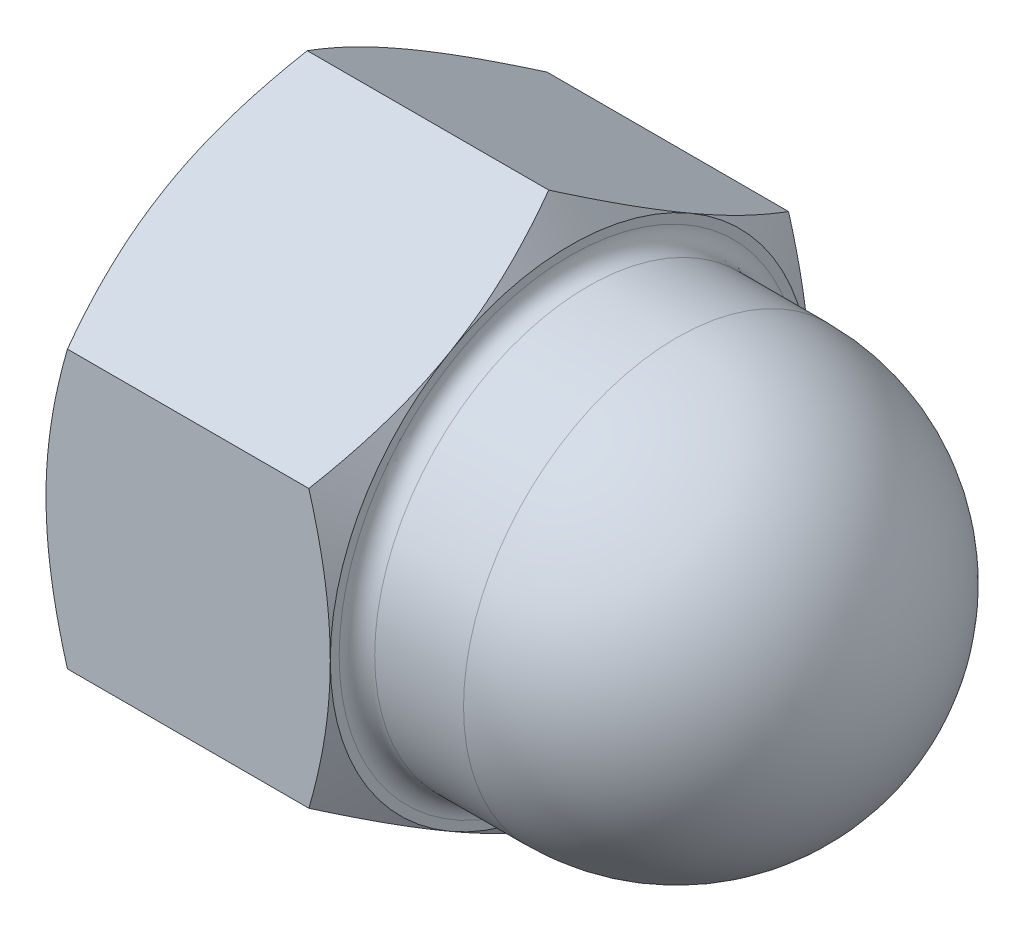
SolidWorks part; units mm, degrees
ref_plane "Plane1" through (0, 0, 0) normal (0, 0, 1) x (1, 0, 0)
ref_plane "Plane2" through (0, 0, 0) normal (0, 1, 0) x (1, 0, 0)
ref_plane "Plane3" through (0, 0, 0) normal (1, 0, 0) x (0, 0, -1)
sketch "BaseNutSke" plane through (0, 0, 0) normal (1, 0, 0) x (0, 0, -1)
  line L6 (13.5, 7.7942) -> (13.5, -7.7942)
  line L7 (-13.5, 7.7942) -> (-13.5, -7.7942)
  line L8 (13.5, 7.7942) -> (0, 15.5885)
  line L9 (0, 15.5885) -> (-13.5, 7.7942)
  line L10 (-13.5, -7.7942) -> (0, -15.5885)
  line L11 (0, -15.5885) -> (13.5, -7.7942)
  dimension "D4" = 60
  dimension "D1" = 120
  dimension "D2" = 13.5
  dimension "D3" = 13.5
  dimension "Width_flats" = 27
extrude "BaseNut" add sketch "BaseNutSke" along normal blind 16
sketch "DomeSke" plane through (0, 0, 0) normal (0, 0, 1) x (1, 0, 0)
  line L0 (0, 0) -> (63.5, 0) construction
  line L1 (0, 7.7942) -> (0, -7.7942) construction
  line L2 (34, 0) -> (0, 0)
  line L3 (0, 12) -> (22, 12)
  line L4 (0, -12) -> (22.225, -12) construction
  line L5 (0, 12) -> (0, 0)
  arc A0 (22, 12) -> (34, 0) centre (22, 0) cw
  dimension "Dome_rad" = 12
  dimension "Overall_ht" = 34
revolve "Dome" add sketch "DomeSke" angle 360 about L0
sketch "Sketch4" plane through (0, 0, 0) normal (0, 0, 1) x (1, 0, 0)
  line L0 (0, 13.5) -> (2.5048, 17.8385)
  line L1 (16, 13.5) -> (13.4952, 17.8385)
  line L2 (2.5048, 17.8385) -> (13.4952, 17.8385)
  line L3 (16, 13.5) -> (18, 13.5)
  line L4 (18, 13.5) -> (18, 28.5)
  line L5 (18, 28.5) -> (-2, 28.5)
  line L6 (0, 13.5) -> (-2, 13.5)
  line L7 (-2, 13.5) -> (-2, 28.5)
  line L8 (16, 15.5885) -> (16, 7.7942) construction
  line L9 (0, 15.5885) -> (0, 7.7942) construction
  line L10 (0, 0) -> (57.15, 0) construction
  line L11 (16, 15.5885) -> (0, 15.5885) construction
  point P17 (16, 13.5)
  dimension "D1" = 30
  dimension "D2" = 30
  dimension "D3" = 2
  dimension "D4" = 2
  dimension "D5" = 2.25
  dimension "D6" = 15
  dimension "D7" = 13.5
revolve "DoubleChamfer" cut sketch "Sketch4" angle 360 about L10
sketch "TapDriSke" plane through (0, 0, 0) normal (0, 0, 1) x (1, 0, 0)
  line L0 (0, 0) -> (44.45, 0) construction
  line L1 (0, 8.75) -> (27, 8.75)
  line L2 (0, 0) -> (0, -11.6913) construction
  line L3 (27, 8.75) -> (32.2575, 0)
  line L4 (0, 0) -> (63.5, 0) construction
  line L5 (32.2575, 0) -> (0, 0)
  line L6 (0, 0) -> (0, 8.75)
  line L7 (27, -8.75) -> (32.2575, 0) construction
  line L8 (0, -8.75) -> (27, -8.75) construction
  line L9 (0.5, 6.35) -> (0.5, 3.175) construction
  dimension "TPA" = 118
  dimension "Thread_min" = 17.5
  dimension "Drill_depth" = 27
  dimension "Drill_clr" = 1
revolve "TapDrill" cut sketch "TapDriSke"
revolve "EndChamfer" cut sketch "EndChamferSketch" angle 360 about L4
sketch "EndChamferSketch" plane through (0, 0, 0) normal (0, 0, 1) x (1, 0, 0)
  line L0 (-0.0254, 10) -> (0.0254, 10)
  line L1 (0.0254, 10) -> (0.9882, 8.625)
  line L2 (0.9882, 8.625) -> (-0.0254, 8.625)
  line L3 (-0.0254, 8.625) -> (-0.0254, 10)
  line L4 (0, 0) -> (-15.875, 0) construction
  dimension "D1" = 0.0508
  dimension "D2" = 35
  dimension "D3" = 0.0254
  dimension "ChamferDepth" = 1.375
  dimension "ThreadMajor" = 10
sketch "GrvSke" plane through (0, 0, 0) normal (0, 0, 1) x (1, 0, 0)
  line L0 (0, 0) -> (38.1, 0) construction
  line L1 (16, 10.5) -> (16, 7.75)
  line L2 (16, 7.75) -> (23, 7.75)
  line L3 (23, 7.75) -> (23, 10.5)
  line L4 (23, 10.5) -> (16, 10.5)
  line L5 (16, 0) -> (16, 11.6913) construction
  line L6 (27, 8.75) -> (0, 8.75) construction
  dimension "D1" = 1
  dimension "Groove_wid" = 7
  dimension "Groove_dia" = 21
revolve "Groove" cut sketch "GrvSke" angle 360 about L0
sketch "ThdSchSke" plane through (0, 0, 0) normal (0, 1, 0) x (1, 0, 0)
  line L0 (0.0381, 10) -> (-0.8372, 8.75)
  line L1 (-0.8372, 8.75) -> (-0.8372, 4.375)
  line L2 (-0.8372, 4.375) -> (0.9134, 4.375)
  line L3 (0.9134, 4.375) -> (0.9134, 8.75)
  line L4 (0.9134, 8.75) -> (0.0381, 10)
  line L5 (-38.1, 0) -> (3.175, 0) construction
  line L6 (0, 0) -> (-15.875, 0) construction
  line L7 (0, 0) -> (63.5, 0) construction
  line L9 (2.5381, 0.475) -> (2.5381, -5.875) construction
  dimension "D1" = 0.0381
  dimension "VeeAngle" = 70
  dimension "SideAngle" = 55
  dimension "Thread_major" = 20
  dimension "Tap_drill" = 17.5
  dimension "OverCut" = 8.75
  dimension "Advance" = 2.5
revolve "ThreadSchematic" [suppressed] cut sketch "ThdSchSke" angle 360 about L5
pattern_linear "ThdSchPat" [suppressed]
fillet "DomeFillet" radius 1 1 edges at (16, 0, -12)
equation "' \"Width_flats@BaseNutSke\" = 27"
equation "' \"Hex_ht@BaseNut\" = 16"
equation "' \"Overall_ht@DomeSke\" = 34"
equation "' \"Dome_rad@DomeSke\" = 12"
equation "' \"Thread_min@TapDriSke\" = 17.5"
equation "' \"Drill_clr@TapDriSke\" = 1.0"
equation "' \"Advance@ThdSchSke\" = 2.5"
equation "' \"Thread_nominal@ThreadCosmetic\" = 20"
equation "' \"Radius@DomeFillet\" = 1.0"
equation "' \"Groove_wid@GrvSke\" = 7"
equation "\"Drill_depth@TapDriSke\" = \"Overall_ht@DomeSke\"  - \"Drill_clr@TapDriSke\" - 0.3 * \"Thread_nominal@ThreadCosmetic\""
equation "\"Groove_dia@GrvSke\" = \"Thread_nominal@ThreadCosmetic\" * 1.05"
equation "\"Thread_depth@ThreadCosmetic\" = \"Thread_nominal@ThreadCosmetic\""
equation "\"D2@BaseNutSke\" = \"Width_flats@BaseNutSke\" / 2"
equation "\"D3@BaseNutSke\" = \"Width_flats@BaseNutSke\" / 2"
equation "\"D7@Sketch4\" = \"Width_flats@BaseNutSke\" / 2"
equation "\"D5@Sketch4\" = \"Width_flats@BaseNutSke\" / 12"
equation "\"Thread_major@ThdSchSke\" = \"Thread_nominal@ThreadCosmetic\""
equation "\"Tap_drill@ThdSchSke\" = \"Thread_min@TapDriSke\""
equation "\"Overcut@ThdSchSke\" = \"Tap_drill@ThdSchSke\" * 0.5"
equation "\"Num_threads@ThdSchPat\" = int(  ( \"Hex_ht@BaseNut\" - 0.002 ) / \"Advance@ThdSchSke\" + 0.999 )  + 1"
equation "' \"Num_threads@ThdSchPat\" = int(  ( \"Thread_depth@ThreadCosmetic\" - 0.002 ) / \"Advance@ThdSchSke\" + 0.999 )  + 1"
equation "\"Advance@ThdSchPat\" = ( \"Hex_ht@BaseNut\" - 0.002 ) /  (\"Num_threads@ThdSchPat\" - 1) 'relax it"
equation "' \"Advance@ThdSchPat\" = ( \"Thread_depth@ThreadCosmetic\" - 0.002 ) /  (\"Num_threads@ThdSchPat\" - 1) 'relax it"
equation "\"ThreadMajor@EndChamferSketch\" = \"Thread_nominal@ThreadCosmetic\" * 0.5"
equation "\"ChamferDepth@EndChamferSketch\" = (\"Thread_nominal@ThreadCosmetic\" - \"Thread_min@TapDriSke\") * 0.55"
